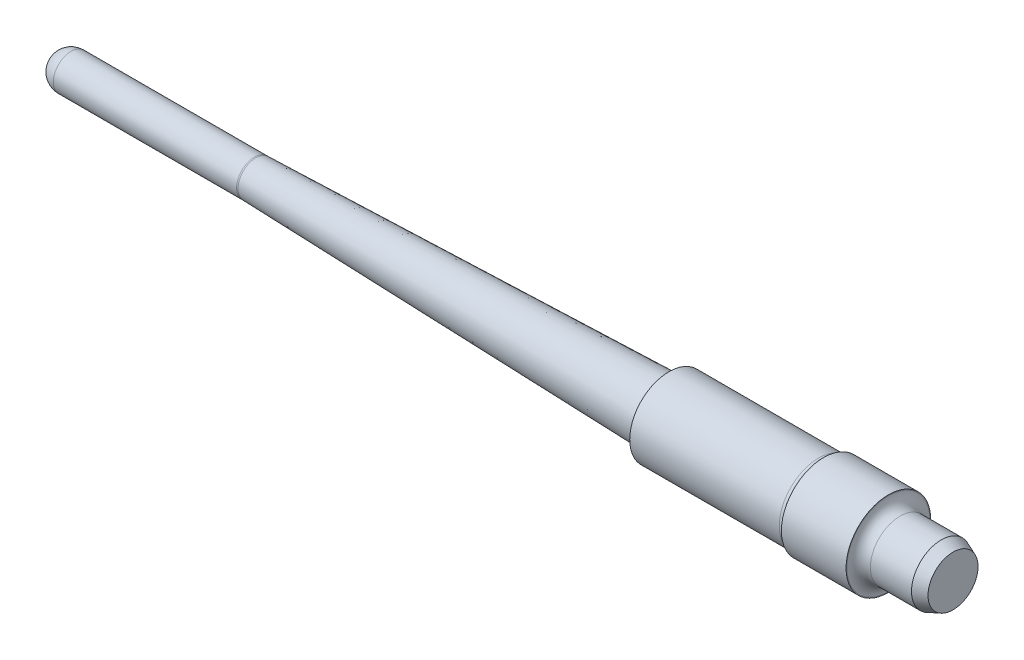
SolidWorks part; units mm, degrees
ref_plane "Front Plane" through (0, 0, 0) normal (0, 0, 1) x (1, 0, 0)
ref_plane "Top Plane" through (0, 0, 0) normal (0, 1, 0) x (1, 0, 0)
ref_plane "Right Plane" through (0, 0, 0) normal (1, 0, 0) x (0, 0, -1)
sketch "Sketch1" plane through (0, 0, 0) normal (0, 0, 1) x (1, 0, 0)
  line L0 (0, 0) -> (58.3184, 0) construction
  line L1 (0, 0) -> (58.3184, 0)
  line L2 (58.3184, 0) -> (58.3184, 1.93)
  line L3 (58.3184, 1.93) -> (54.1274, 1.93)
  line L4 (54.1274, 1.93) -> (54.1274, 2.743)
  line L5 (54.1274, 2.743) -> (49.9364, 2.743)
  line L6 (49.9364, 2.743) -> (49.9364, 2.54)
  line L7 (49.9364, 2.54) -> (39.9034, 2.54)
  line L8 (39.9034, 2.54) -> (39.9034, 1.943)
  line L10 (1.156, 1.156) -> (13.0344, 1.156)
  line L11 (13.1275, 1.1574) -> (39.9034, 1.943)
  arc A0 (0, 0) -> (1.156, 1.156) centre (1.156, 0) cw
  arc A1 (13.0344, 1.156) -> (13.1275, 1.1574) centre (13.0344, 4.331) ccw
  point P15 (13.081, 1.156)
  dimension "D10" = 13.081
  dimension "D11" = 3.175
  dimension "D1" = 58.3184
  dimension "D2" = 1.93
  dimension "D3" = 4.191
  dimension "D4" = 2.743
  dimension "D5" = 4.191
  dimension "D6" = 2.54
  dimension "D7" = 1.943
  dimension "D8" = 14.224
  dimension "D9" = 1.156
revolve "Revolve1" add sketch "Sketch1" angle 360 about L0
chamfer "Chamfer1" distance 0.762 angle 22 1 edges at (58.3184, 0, 1.93)
fillet "Fillet1" radius 0.762 1 edges at (54.1274, 0, 1.93)
fillet "Fillet2" radius 0.381 2 edges at (39.9034, 0, 1.943) (49.9364, 0, 2.54)
